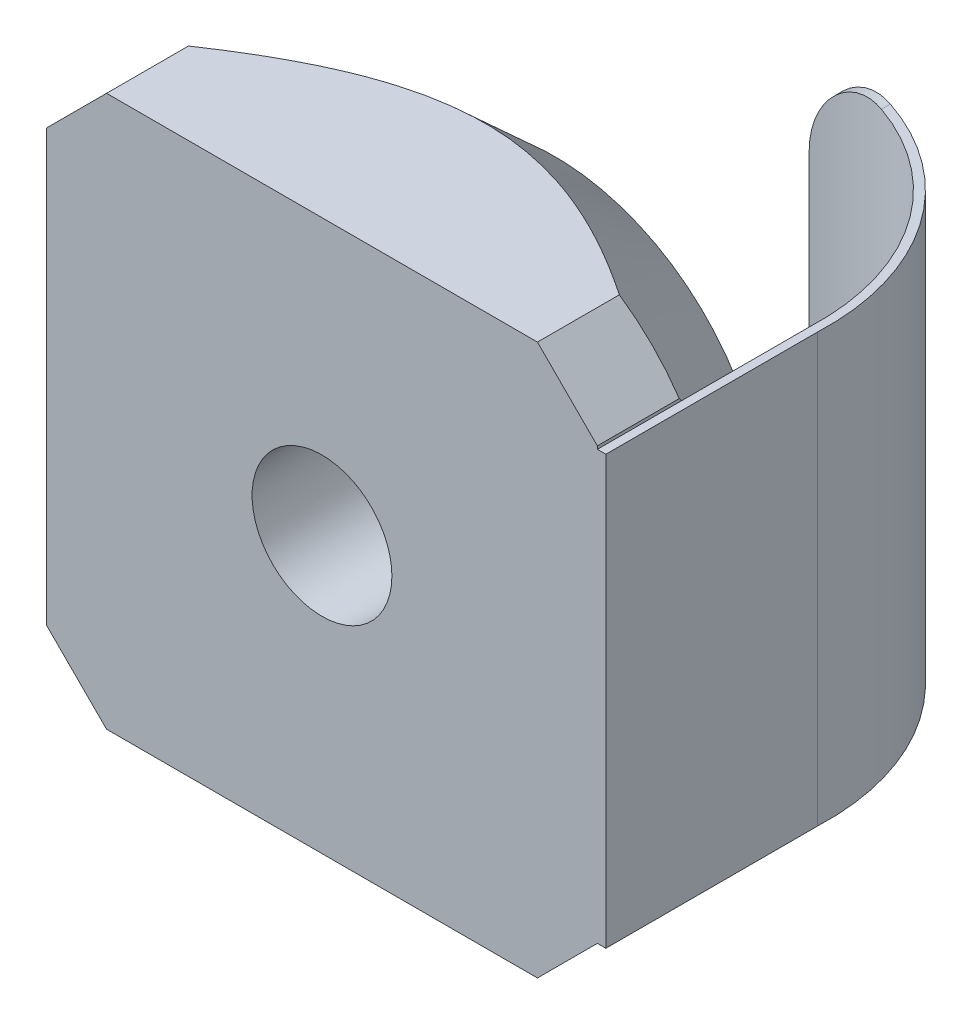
SolidWorks part; units mm, degrees
ref_plane "Front" through (0, 0, 0) normal (0, 0, 1) x (1, 0, 0)
ref_plane "Top" through (0, 0, 0) normal (0, 1, 0) x (1, 0, 0)
ref_plane "Right" through (0, 0, 0) normal (1, 0, 0) x (0, 0, -1)
imported_body "Imported1"
hole_wizard "M4x0.7 Tapped Hole1" positions "3DSketch1" profile "Sketch1" tap size "M4x0.7" standard "Ansi Metric"
sketch3d "3DSketch1"
  line L0 (-6.5, 5.0858, 0) -> (-6.5, -5.0858, 0) construction
  line L1 (5.0858, 6.5, 0) -> (-5.0858, 6.5, 0) construction
  point P0 (0, 0, 0)
  dimension "D1" = 6.5
  dimension "D2" = 6.5
sketch "Sketch1" plane through (0, 0, 0) normal (1, 0, 0) x (0, -1, 0)
  line L0 (0, 0) -> (0, 6.9914)
  line L1 (0, 6.9914) -> (1.65, 6)
  line L2 (1.65, 6) -> (1.65, 0)
  line L5 (1.65, 0) -> (0, 0)
  line L10 (0, 6.9914) -> (-1.65, 6) construction
  line L11 (0, -6.35) -> (0, 107.95) construction
  dimension "Tap Drill Dia." = 3.3
  dimension "Tap Drill Depth" = 6
  dimension "Drill Angle" = 118
